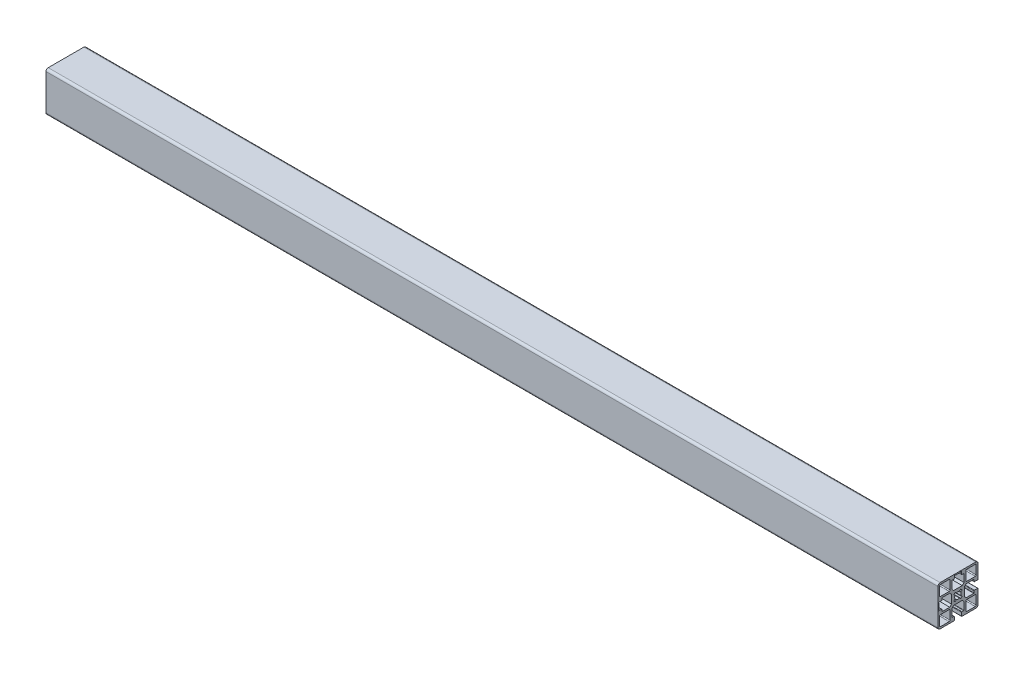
SolidWorks part; units mm, degrees
ref_plane "Front Plane" through (0, 0, 0) normal (0, 0, 1) x (1, 0, 0)
ref_plane "Top Plane" through (0, 0, 0) normal (0, 1, 0) x (1, 0, 0)
ref_plane "Right Plane" through (0, 0, 0) normal (1, 0, 0) x (0, 0, -1)
sketch3d "3DSketch1"
  line L0 (0, 0, 0) -> (1000, 0, 0)
  dimension "D1" = 1000
other "45-sarja 1.0106 45X45 L 2SS(1)"
ref_plane "Plane1" through (0, 0, 0) normal (1, 0, 0) x (0, 0, -1)
sketch "Model5" plane through (0, 0, 0) normal (1, 0, 0) x (0, 0, -1)
  line L0 (6.5, 18) -> (4.6, 18)
  line L1 (4.1, 18.5) -> (4.1, 22.2)
  line L2 (4.1, 22.2) -> (3.8, 22.2)
  line L3 (1.75, 21) -> (-1.75, 21)
  line L4 (-3.8, 22.2) -> (-4.1, 22.2)
  line L5 (-4.1, 22.2) -> (-4.1, 18.5)
  line L6 (-4.6, 18) -> (-6.5, 18)
  line L7 (-6.8, 17.7) -> (-6.8, 9.2)
  line L8 (-6.8, 9.2) -> (-4.8, 7.2)
  line L9 (-4.8, 7.2) -> (4.8, 7.2)
  line L10 (4.8, 7.2) -> (6.8, 9.2)
  line L11 (6.8, 9.2) -> (6.8, 17.7)
  line L12 (20.5, 9.8) -> (20.5, 19.5)
  line L13 (19.5, 20.5) -> (9.8, 20.5)
  line L14 (8.8, 19.5) -> (8.8, 9.8)
  line L15 (9.8, 8.8) -> (19.5, 8.8)
  line L16 (-9.8, 20.5) -> (-19.5, 20.5)
  line L17 (-20.5, 19.5) -> (-20.5, 9.8)
  line L18 (-19.5, 8.8) -> (-9.8, 8.8)
  line L19 (-8.8, 9.8) -> (-8.8, 19.5)
  line L20 (3.3633, 1.9491) -> (4.3841, 2.9698)
  line L21 (4.3841, 3.3941) -> (3.3941, 4.3841)
  line L22 (2.9698, 4.3841) -> (1.9491, 3.3633)
  line L23 (-1.9491, 3.3633) -> (-2.9698, 4.3841)
  line L24 (-3.3941, 4.3841) -> (-4.3841, 3.3941)
  line L25 (-4.3841, 2.9698) -> (-3.3633, 1.9491)
  line L26 (-3.3633, -1.9491) -> (-4.3841, -2.9698)
  line L27 (-4.3841, -3.3941) -> (-3.3941, -4.3841)
  line L28 (-2.9698, -4.3841) -> (-1.9491, -3.3633)
  line L29 (1.9491, -3.3633) -> (2.9698, -4.3841)
  line L30 (3.3941, -4.3841) -> (4.3841, -3.3941)
  line L31 (4.3841, -2.9698) -> (3.3633, -1.9491)
  line L32 (19.5, -8.8) -> (9.8, -8.8)
  line L33 (8.8, -9.8) -> (8.8, -19.5)
  line L34 (9.8, -20.5) -> (19.5, -20.5)
  line L35 (20.5, -19.5) -> (20.5, -9.8)
  line L36 (-19.5, -20.5) -> (-9.8, -20.5)
  line L37 (-8.8, -19.5) -> (-8.8, -9.8)
  line L38 (-9.8, -8.8) -> (-19.5, -8.8)
  line L39 (-20.5, -9.8) -> (-20.5, -19.5)
  line L40 (-4.6, -18) -> (-6.5, -18)
  line L41 (-4.1, -22.2) -> (-4.1, -18.5)
  line L42 (-20, -22.5) -> (-4.4, -22.5)
  line L43 (-22.5, 20) -> (-22.5, -20)
  line L44 (-18.5, -4.1) -> (-22.2, -4.1)
  line L45 (-18, -6.5) -> (-18, -4.6)
  line L46 (-9.2, -6.8) -> (-17.7, -6.8)
  line L47 (-7.2, -4.8) -> (-9.2, -6.8)
  line L48 (-7.2, 4.8) -> (-7.2, -4.8)
  line L49 (-9.2, 6.8) -> (-7.2, 4.8)
  line L50 (-17.7, 6.8) -> (-9.2, 6.8)
  line L51 (-18, 4.6) -> (-18, 6.5)
  line L52 (-22.2, 4.1) -> (-18.5, 4.1)
  line L54 (20, 22.5) -> (-20, 22.5)
  line L55 (22.5, 4.4) -> (22.5, 20)
  line L56 (18.5, 4.1) -> (22.2, 4.1)
  line L57 (18, 6.5) -> (18, 4.6)
  line L58 (9.2, 6.8) -> (17.7, 6.8)
  line L59 (7.2, 4.8) -> (9.2, 6.8)
  line L60 (7.2, -4.8) -> (7.2, 4.8)
  line L61 (9.2, -6.8) -> (7.2, -4.8)
  line L62 (17.7, -6.8) -> (9.2, -6.8)
  line L63 (18, -4.6) -> (18, -6.5)
  line L64 (22.2, -4.1) -> (18.5, -4.1)
  line L65 (22.5, -20) -> (22.5, -4.4)
  line L66 (4.4, -22.5) -> (20, -22.5)
  line L67 (4.1, -18.5) -> (4.1, -22.2)
  line L68 (6.5, -18) -> (4.6, -18)
  line L69 (6.8, -9.2) -> (6.8, -17.7)
  line L70 (4.8, -7.2) -> (6.8, -9.2)
  line L71 (-4.8, -7.2) -> (4.8, -7.2)
  line L72 (-6.8, -9.2) -> (-4.8, -7.2)
  line L73 (-6.8, -17.7) -> (-6.8, -9.2)
  line L74 (-21, 1.75) -> (-21, -1.75)
  line L75 (-22.2, -4.1) -> (-22.2, -3.7994)
  line L76 (-22.2, 4.1) -> (-22.2, 3.7994)
  arc A0 (4.1, 18.5) -> (4.6, 18) centre (4.6, 18.5) ccw
  arc A1 (1.75, 21) -> (3.8, 22.2) centre (1.75, 23.351) ccw
  arc A2 (-3.8, 22.2) -> (-1.75, 21) centre (-1.75, 23.351) ccw
  arc A3 (-4.6, 18) -> (-4.1, 18.5) centre (-4.6, 18.5) ccw
  arc A4 (-6.5, 18) -> (-6.8, 17.7) centre (-6.5, 17.7) ccw
  arc A5 (6.8, 17.7) -> (6.5, 18) centre (6.5, 17.7) ccw
  arc A6 (19.5, 8.8) -> (20.5, 9.8) centre (19.5, 9.8) ccw
  arc A7 (20.5, 19.5) -> (19.5, 20.5) centre (19.5, 19.5) ccw
  arc A8 (9.8, 20.5) -> (8.8, 19.5) centre (9.8, 19.5) ccw
  arc A9 (8.8, 9.8) -> (9.8, 8.8) centre (9.8, 9.8) ccw
  arc A10 (-8.8, 19.5) -> (-9.8, 20.5) centre (-9.8, 19.5) ccw
  arc A11 (-19.5, 20.5) -> (-20.5, 19.5) centre (-19.5, 19.5) ccw
  arc A12 (-20.5, 9.8) -> (-19.5, 8.8) centre (-19.5, 9.8) ccw
  arc A13 (-9.8, 8.8) -> (-8.8, 9.8) centre (-9.8, 9.8) ccw
  arc A14 (4.3841, 2.9698) -> (4.3841, 3.3941) centre (4.1719, 3.182) ccw
  arc A15 (3.3941, 4.3841) -> (2.9698, 4.3841) centre (3.182, 4.1719) ccw
  arc A16 (1.6059, 3.3056) -> (1.9491, 3.3633) centre (1.7369, 3.5754) ccw
  arc A17 (1.6059, 3.3056) -> (-1.6059, 3.3056) centre (0, 0) ccw
  arc A18 (-1.9491, 3.3633) -> (-1.6059, 3.3056) centre (-1.7369, 3.5754) ccw
  arc A19 (-2.9698, 4.3841) -> (-3.3941, 4.3841) centre (-3.182, 4.1719) ccw
  arc A20 (-4.3841, 3.3941) -> (-4.3841, 2.9698) centre (-4.1719, 3.182) ccw
  arc A21 (-3.3056, 1.6059) -> (-3.3633, 1.9491) centre (-3.5754, 1.7369) ccw
  arc A22 (-3.3056, 1.6059) -> (-3.3056, -1.6059) centre (0, 0) ccw
  arc A23 (-3.3633, -1.9491) -> (-3.3056, -1.6059) centre (-3.5754, -1.7369) ccw
  arc A24 (-4.3841, -2.9698) -> (-4.3841, -3.3941) centre (-4.1719, -3.182) ccw
  arc A25 (-3.3941, -4.3841) -> (-2.9698, -4.3841) centre (-3.182, -4.1719) ccw
  arc A26 (-1.6059, -3.3056) -> (-1.9491, -3.3633) centre (-1.7369, -3.5754) ccw
  arc A27 (-1.6059, -3.3056) -> (1.6059, -3.3056) centre (0, 0) ccw
  arc A28 (1.9491, -3.3633) -> (1.6059, -3.3056) centre (1.7369, -3.5754) ccw
  arc A29 (2.9698, -4.3841) -> (3.3941, -4.3841) centre (3.182, -4.1719) ccw
  arc A30 (4.3841, -3.3941) -> (4.3841, -2.9698) centre (4.1719, -3.182) ccw
  arc A31 (3.3056, -1.6059) -> (3.3633, -1.9491) centre (3.5754, -1.7369) ccw
  arc A32 (3.3056, -1.6059) -> (3.3056, 1.6059) centre (0, 0) ccw
  arc A33 (3.3633, 1.9491) -> (3.3056, 1.6059) centre (3.5754, 1.7369) ccw
  arc A34 (20.5, -9.8) -> (19.5, -8.8) centre (19.5, -9.8) ccw
  arc A35 (9.8, -8.8) -> (8.8, -9.8) centre (9.8, -9.8) ccw
  arc A36 (8.8, -19.5) -> (9.8, -20.5) centre (9.8, -19.5) ccw
  arc A37 (19.5, -20.5) -> (20.5, -19.5) centre (19.5, -19.5) ccw
  arc A38 (-20.5, -19.5) -> (-19.5, -20.5) centre (-19.5, -19.5) ccw
  arc A39 (-9.8, -20.5) -> (-8.8, -19.5) centre (-9.8, -19.5) ccw
  arc A40 (-8.8, -9.8) -> (-9.8, -8.8) centre (-9.8, -9.8) ccw
  arc A41 (-19.5, -8.8) -> (-20.5, -9.8) centre (-19.5, -9.8) ccw
  arc A42 (-4.1, -18.5) -> (-4.6, -18) centre (-4.6, -18.5) ccw
  arc A43 (-4.4, -22.5) -> (-4.1, -22.2) centre (-4.4, -22.2) ccw
  arc A44 (-22.5, -20) -> (-20, -22.5) centre (-20, -20) ccw
  arc A46 (-18, -4.6) -> (-18.5, -4.1) centre (-18.5, -4.6) ccw
  arc A47 (-18, -6.5) -> (-17.7, -6.8) centre (-17.7, -6.5) ccw
  arc A48 (-17.7, 6.8) -> (-18, 6.5) centre (-17.7, 6.5) ccw
  arc A49 (-18.5, 4.1) -> (-18, 4.6) centre (-18.5, 4.6) ccw
  arc A50 (-21, 1.75) -> (-22.2, 3.7994) centre (-23.35, 1.75) ccw
  arc A51 (-20, 22.5) -> (-22.5, 20) centre (-20, 20) ccw
  arc A52 (22.5, 20) -> (20, 22.5) centre (20, 20) ccw
  arc A53 (22.2, 4.1) -> (22.5, 4.4) centre (22.2, 4.4) ccw
  arc A54 (18, 4.6) -> (18.5, 4.1) centre (18.5, 4.6) ccw
  arc A55 (18, 6.5) -> (17.7, 6.8) centre (17.7, 6.5) ccw
  arc A56 (17.7, -6.8) -> (18, -6.5) centre (17.7, -6.5) ccw
  arc A57 (18.5, -4.1) -> (18, -4.6) centre (18.5, -4.6) ccw
  arc A58 (22.5, -4.4) -> (22.2, -4.1) centre (22.2, -4.4) ccw
  arc A59 (20, -22.5) -> (22.5, -20) centre (20, -20) ccw
  arc A60 (4.1, -22.2) -> (4.4, -22.5) centre (4.4, -22.2) ccw
  arc A61 (4.6, -18) -> (4.1, -18.5) centre (4.6, -18.5) ccw
  arc A62 (6.5, -18) -> (6.8, -17.7) centre (6.5, -17.7) ccw
  arc A63 (-6.8, -17.7) -> (-6.5, -18) centre (-6.5, -17.7) ccw
  arc A64 (-22.2, -3.7994) -> (-21, -1.75) centre (-23.35, -1.75) ccw
  point P124 (0, 0)
  point P199 (0, 0)
  point P200 (0, 22.5)
  point P201 (-22.5, 0)
  point P202 (22.5, 0)
  point P203 (0, -22.5)
  point P204 (-22.5, 22.5)
  point P205 (22.5, 22.5)
  point P206 (22.5, -22.5)
  point P207 (-22.5, -22.5)
  point P211 (-21, 0)
